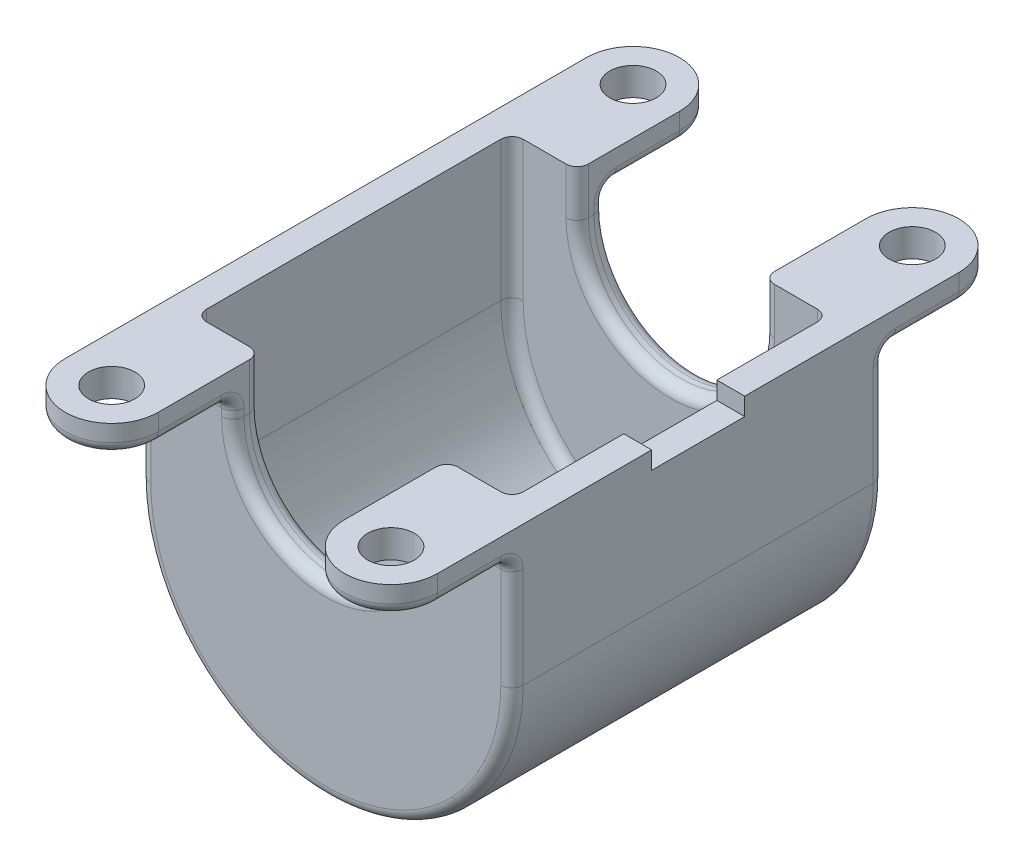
SolidWorks part; units mm, degrees
ref_plane "Front Plane" through (0, 0, 0) normal (0, 0, 1) x (1, 0, 0)
ref_plane "Top Plane" through (0, 0, 0) normal (0, 1, 0) x (1, 0, 0)
ref_plane "Right Plane" through (0, 0, 0) normal (1, 0, 0) x (0, 0, -1)
sketch "Sketch1" plane through (0, 0, 0) normal (0, 0, 1) x (1, 0, 0)
  line L0 (25.4, 12.7) -> (25.4, 0)
  line L1 (-25.4, 0) -> (-25.4, 12.7)
  line L2 (-25.4, 12.7) -> (-50.8, 12.7)
  line L3 (-50.8, 12.7) -> (-50.8, -25.4)
  line L4 (50.8, -25.4) -> (50.8, 12.7)
  line L5 (50.8, 12.7) -> (25.4, 12.7)
  arc A0 (25.4, 0) -> (-25.4, 0) centre (0, 0) cw
  arc A1 (-50.8, -25.4) -> (50.8, -25.4) centre (0, -25.4) ccw
  dimension "D2" = 25.4
  dimension "D3" = 50.8
  dimension "D1" = 38.1
extrude "Extrude1" add sketch "Sketch1" along normal mid plane 101.6
shell "Shell1" thickness 7.62
sketch "Sketch2" plane through (0, 12.7, 0) normal (0, 1, 0) x (-1, 0, 0)
  line L1 (50.8, 50.8) -> (25.4, 50.8)
  line L2 (50.8, 50.8) -> (50.8, 71.12)
  line L4 (25.4, 50.8) -> (25.4, 71.12)
  arc A0 (50.8, 71.12) -> (25.4, 71.12) centre (38.1, 71.12) ccw
  dimension "D1" = 20.32
extrude "Extrude2" add sketch "Sketch2" against normal blind 7.62
hole_wizard "1/2 (0.5) Diameter Hole1" positions "Sketch4" profile "Sketch3" hole size "1/2" standard "Ansi Inch"
sketch "Sketch4" plane through (0, 12.7, 0) normal (0, 1, 0) x (-1, 0, 0)
  point P0 (38.1, 71.12)
sketch "Sketch3" plane through (-38.1, 12.7, 71.12) normal (1, 0, 0) x (0, 0, 1)
  line L0 (0, 0) -> (0, 88.9)
  line L1 (0, 88.9) -> (6.35, 88.9)
  line L2 (6.35, 88.9) -> (6.35, 0)
  line L5 (6.35, 0) -> (0, 0)
  line L11 (0, -6.35) -> (0, 107.95) construction
  dimension "Thru Hole Dia." = 12.7
  dimension "Thru Hole Depth" = 88.9
mirror "Mirror1" about plane through (0, 0, 0) normal (1, 0, 0) of "1/2 (0.5) Diameter Hole1", "Extrude2"
mirror "Mirror2" about plane through (0, 0, 0) normal (0, 0, 1) of "Mirror1", "Extrude2", "1/2 (0.5) Diameter Hole1"
sketch "Sketch5" plane through (50.8, 0, 0) normal (1, 0, 0) x (0, 0, -1)
  line L0 (-71.12, 12.7) -> (71.12, 12.7) construction
  line L1 (-12.7, 12.7) -> (12.7, 12.7)
  line L2 (-12.7, 12.7) -> (-12.7, 7.874)
  line L3 (-12.7, 7.874) -> (12.7, 7.874)
  line L4 (12.7, 12.7) -> (12.7, 7.874)
  line L5 (0, 0) -> (0, 12.7) construction
  dimension "D1" = 25.4
  dimension "D2" = 4.826
extrude "Cut-Extrude1" cut sketch "Sketch5" against normal up to next
fillet "Fillet1" radius 3.048 16 edges at (25.4, 6.35, 43.18) (-25.4, 6.35, 43.18) (-43.18, -6.35, 43.18) (43.18, -6.35, 43.18) (25.4, 6.35, -43.18) (-25.4, 6.35, -43.18) (-43.18, -6.35, -43.18) (43.18, -6.35, -43.18) (-38.1, 5.08, -50.8) (38.1, 5.08, 50.8) (0, -25.4, 43.18) (0, -68.58, 43.18) (0, -25.4, -43.18) (0, -68.58, -43.18)
fillet "Fillet2" radius 3.048 32 edges at (25.4, 1.016, 50.8) (25.4, 4.1873, 51.6927) (25.4, 5.08, 62.484) (50.8, 5.08, 62.484) (38.1, 5.08, 83.82) (50.8, 4.1873, 51.6927) (50.8, -11.684, 50.8) (0, -76.2, 50.8) (-50.8, 4.1873, 51.6927) (-38.1, 5.08, 83.82) (-25.4, 4.1873, 51.6927) (25.4, 4.1873, -51.6927) (38.1, 5.08, -83.82) (50.8, 4.1873, -51.6927) (0, -76.2, -50.8) (-50.8, -11.684, -50.8) (-50.8, 4.1873, -51.6927) (-25.4, 5.08, -62.484) (-50.8, 5.08, -62.484) (-38.1, 5.08, -83.82) (-25.4, 4.1873, -51.6927) (-25.4, 1.016, -50.8) (0, -25.4, 50.8) (0, -25.4, -50.8)
